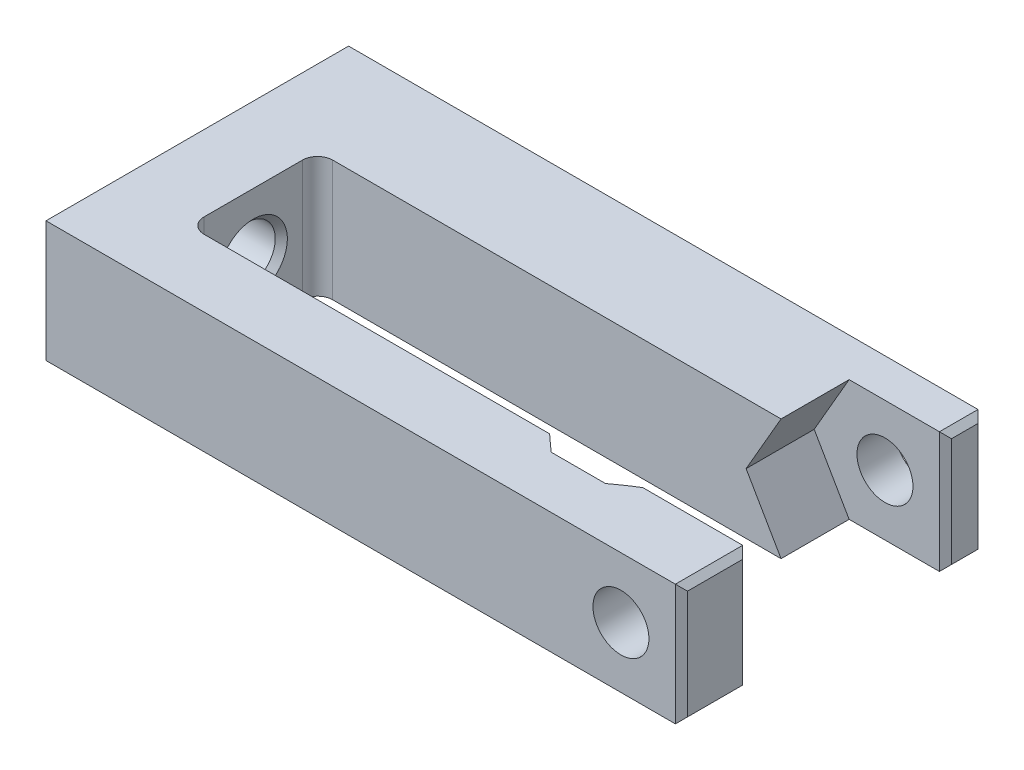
SolidWorks part; units mm, degrees
ref_plane "Front Plane" through (0, 0, 0) normal (0, 0, 1) x (1, 0, 0)
ref_plane "Top Plane" through (0, 0, 0) normal (0, 1, 0) x (1, 0, 0)
ref_plane "Right Plane" through (0, 0, 0) normal (1, 0, 0) x (0, 0, -1)
sketch "Sketch1" plane through (0, 0, 0) normal (0, 1, 0) x (1, 0, 0)
  line L0 (0, 0) -> (42, 0)
  line L1 (42, 0) -> (42, 4.45)
  line L2 (42, 4.45) -> (5, 4.45)
  line L3 (5, 4.45) -> (5, 12.95)
  line L4 (5, 12.95) -> (42, 12.95)
  line L5 (42, 12.95) -> (42, 20)
  line L6 (42, 20) -> (0, 20)
  line L7 (0, 20) -> (0, 0)
  dimension "D1" = 8.5
  dimension "D2" = 5
  dimension "D3" = 4.45
  dimension "D4" = 7.05
  dimension "D5" = 42
extrude "Boss-Extrude1" add sketch "Sketch1" along normal blind 8
sketch "Sketch2" plane through (0, 0, 0) normal (0, 0, 1) x (1, 0, 0)
  line L0 (42, 8) -> (34, 0) construction
  line L1 (0, 0) -> (42, 0) construction
  line L2 (42, 8) -> (42, 0) construction
  circle A0 centre (38, 4) radius 1.85
  dimension "D2" = 3.7
  dimension "D1" = 45
extrude "Cut-Extrude1" cut sketch "Sketch2" against normal through all
sketch "Sketch3" plane through (0, 0, 0) normal (-1, 0, 0) x (0, 0, 1)
  line L0 (-20, 8) -> (0, 8) construction
  line L1 (0, 8) -> (0, 0) construction
  circle A0 centre (-8.7, 4) radius 1.85
  dimension "D1" = 3.7
  dimension "D2" = 4
  dimension "D3" = 8.7
extrude "Cut-Extrude2" cut sketch "Sketch3" against normal through all
fillet "Fillet4" radius 1 2 edges at (5, 4, -4.45) (5, 4, -12.95)
chamfer "Chamfer4" distance 0.4 angle 45 1 edges at (5, 4, -6.85)
sketch "Sketch9" plane through (0, 0, -4.45) normal (0, 0, -1) x (-1, 0, 0)
  line L0 (-33, 0) -> (-33, 8) construction
  line L1 (-42, 0) -> (0, 0) construction
  line L2 (-42, 8) -> (0, 8) construction
  line L3 (-29, 0) -> (-29, 8) construction
  line L4 (-29.9377, 0) -> (-35, 0)
  line L5 (-35, 8) -> (-29.9377, 8)
  circle A0 centre (-38, 4) radius 1.85 construction
  arc A1 (-33, 4) -> (-35, 0) centre (-38, 4) cw
  arc A2 (-33, 4) -> (-35, 8) centre (-38, 4) ccw
  arc A3 (-29, 4) -> (-29.9377, 8) centre (-38, 4) ccw
  arc A4 (-29, 4) -> (-29.9377, 0) centre (-38, 4) cw
  dimension "D1" = 5
  dimension "D2" = 9
extrude "Cut-Extrude7" cut sketch "Sketch9" against normal blind 1
sketch "Sketch4" plane through (0, 0, 0) normal (0, 0, 1) x (1, 0, 0)
  line L0 (38, 5.85) -> (38, 2.15)
  line L1 (38, 2.15) -> (42, 2.15)
  line L2 (42, 8) -> (42, 0) construction
  line L3 (38, 5.85) -> (42, 5.85)
  line L4 (42, 5.85) -> (42, 2.15)
  circle A0 centre (38, 4) radius 1.85 construction
chamfer "Chamfer10" distance 1 angle 45 2 edges at (33, 4, -3.45) (29, 4, -4.45)
sketch "Sketch10" plane through (0, 0, -12.95) normal (0, 0, 1) x (1, 0, 0)
  line L0 (42.6765, 4) -> (42.6765, -0.05)
  line L1 (33.3235, 4) -> (35.6617, -0.05)
  line L2 (35.6617, -0.05) -> (40.3383, -0.05)
  line L3 (40.3383, -0.05) -> (42.6765, 4)
  line L4 (42.6765, 4) -> (40.3383, 8.05)
  line L5 (40.3383, 8.05) -> (35.6617, 8.05)
  line L6 (35.6617, 8.05) -> (33.3235, 4)
  line L7 (42.6765, -0.05) -> (40.3383, -0.05)
  line L8 (42, 0) -> (0, 0) construction
  line L9 (42.6765, 4) -> (42.6765, 8.05)
  line L10 (42.6765, 8.05) -> (40.3383, 8.05)
  line L11 (40.3383, -0.05) -> (42.6765, 4)
  line L12 (40.3383, 8.05) -> (42.6765, 4)
  circle A0 centre (38, 4) radius 4.05 construction
  circle A2 centre (38, 4) radius 1.85 construction
  dimension "D1" = 8.1
extrude "Cut-Extrude8" cut sketch "Sketch10" against normal blind 4.5 contours L6 L1 L3 L4 M2 M4 M5 M1 | L3 M4 M5 | L4 M5 M2
chamfer "Chamfer11" distance 0.4 angle 45 4 edges at (42, 4, 0) (42, 8, -2.225) (42, 4, -4.45) (42, 0, -2.225)
chamfer "Chamfer12" distance 0.4 angle 45 4 edges at (42, 8, -18.725) (42, 4, -20) (42, 0, -18.725) (42, 4, -17.45)
